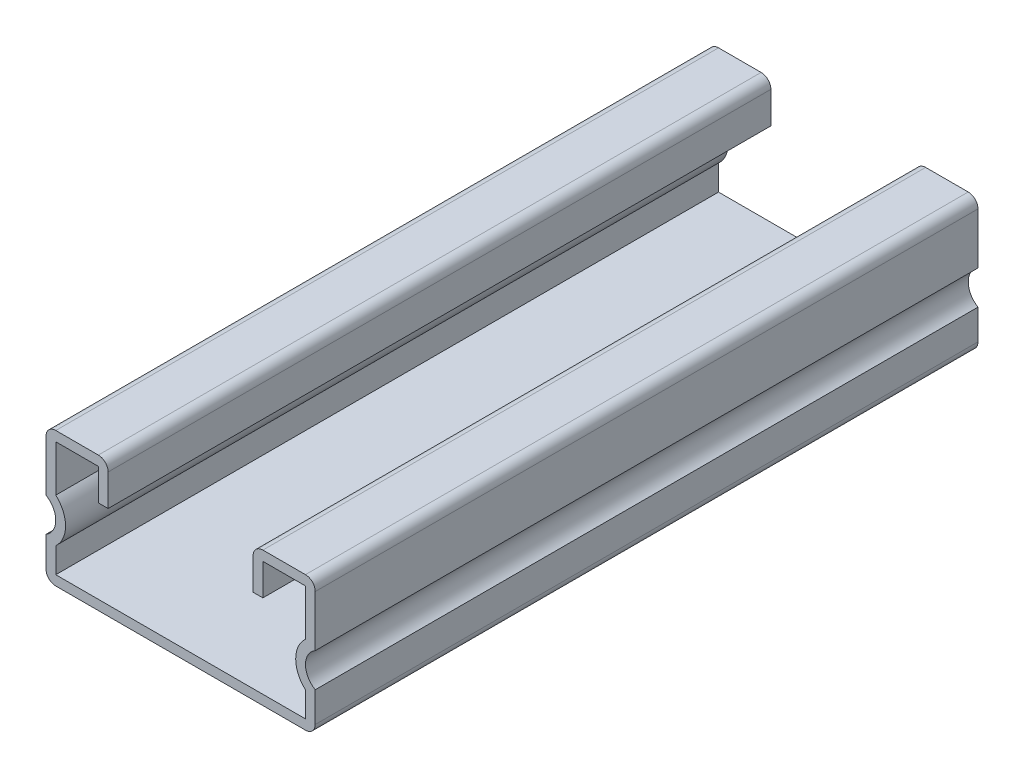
SolidWorks part; units mm, degrees
ref_plane "Plane1" through (0, 0, 0) normal (0, 0, 1) x (1, 0, 0)
ref_plane "Plane2" through (0, 0, 0) normal (0, 1, 0) x (1, 0, 0)
ref_plane "Plane3" through (0, 0, 0) normal (1, 0, 0) x (0, 0, -1)
sketch "Sketch1" plane through (0, 0, 0) normal (0, 0, 1) x (1, 0, 0)
  line L0 (-20.6375, 10.4394) -> (-20.6375, 2.5957)
  line L1 (-20.6375, -2.5957) -> (-20.6375, -7.2136)
  line L2 (-19.1389, -8.7122) -> (19.1389, -8.7122)
  line L3 (20.6375, -7.2136) -> (20.6375, -2.5957)
  line L4 (20.6375, 2.5957) -> (20.6375, 10.4394)
  line L5 (19.1389, 11.938) -> (12.6111, 11.938)
  line L6 (11.1125, 10.4394) -> (11.1125, 5.588)
  line L7 (-19.1389, 11.938) -> (-12.6111, 11.938)
  line L8 (-11.1125, 10.4394) -> (-11.1125, 5.588)
  line L9 (19.1389, -5.2823) -> (19.1389, 6.4389) construction
  line L10 (-19.1389, 6.4389) -> (-19.1389, -5.2823) construction
  line L11 (-12.6111, 10.4394) -> (-12.6111, 5.588)
  line L12 (-19.1389, 10.4394) -> (-12.6111, 10.4394)
  line L13 (-19.1389, 10.4394) -> (-19.1389, 3.351)
  line L14 (-19.1389, -3.351) -> (-19.1389, -7.2136)
  line L15 (-19.1389, -7.2136) -> (19.1389, -7.2136)
  line L16 (19.1389, -7.2136) -> (19.1389, -3.351)
  line L17 (19.1389, 3.351) -> (19.1389, 10.4394)
  line L18 (19.1389, 10.4394) -> (12.6111, 10.4394)
  line L19 (12.6111, 10.4394) -> (12.6111, 5.588)
  line L20 (-12.6111, 5.588) -> (-11.1125, 5.588)
  line L21 (11.1125, 5.588) -> (12.6111, 5.588)
  arc A0 (20.6375, 2.5957) -> (20.6375, -2.5957) centre (22.1361, 0) ccw
  arc A1 (-20.6375, -2.5957) -> (-20.6375, 2.5957) centre (-22.1361, 0) ccw
  arc A2 (-12.6111, 11.938) -> (-11.1125, 10.4394) centre (-12.6111, 10.4394) cw
  arc A3 (-20.6375, 10.4394) -> (-19.1389, 11.938) centre (-19.1389, 10.4394) cw
  arc A4 (-19.1389, -8.7122) -> (-20.6375, -7.2136) centre (-19.1389, -7.2136) cw
  arc A5 (20.6375, -7.2136) -> (19.1389, -8.7122) centre (19.1389, -7.2136) cw
  arc A6 (19.1389, 11.938) -> (20.6375, 10.4394) centre (19.1389, 10.4394) cw
  arc A7 (11.1125, 10.4394) -> (12.6111, 11.938) centre (12.6111, 10.4394) cw
  arc A8 (-19.1389, -3.351) -> (-19.1389, 3.351) centre (-22.1361, 0) ccw
  arc A9 (19.1389, 3.351) -> (19.1389, -3.351) centre (22.1361, 0) ccw
  dimension "D1" = 20.6375
  dimension "D9" = 2.9972
  dimension "D10" = 2.9972
  dimension "Width" = 41.275
  dimension "base" = 8.7122
  dimension "ToeHt" = 11.938
  dimension "D6" = 22.225
  dimension "edge" = 9.525
  dimension "Lip" = 6.35
  dimension "gauge" = 1.4986
extrude "Base-Extrude" add sketch "Sketch1" along normal blind 101.6
other "Hole1"
sketch "Sketch3" plane through (0, -8.7122, 0) normal (0, -1, 0) x (1, 0, 0)
  circle A0 centre (0, 23.8125) radius 7.1438
  dimension "D1" = 14.2875
  dimension "D2" = 23.8125
pattern_linear "LPattern2" count 2 spacing 47.625 along (0, 0, 1) of "Hole1"
equation "\"D1@Sketch1\" = \"Width@Sketch1\" / 2"
equation "\"D6@Sketch1\" = \"Width@Sketch1\" - 2 * \"edge@Sketch1\""
equation "\"D10@Sketch1\" = 2 * \"gauge@Sketch1\""
equation "\"D9@Sketch1\" = \"D10@Sketch1\""
equation "\"D1@LPattern2\" = \"D1@Base-Extrude\" / \"D3@LPattern2\""
